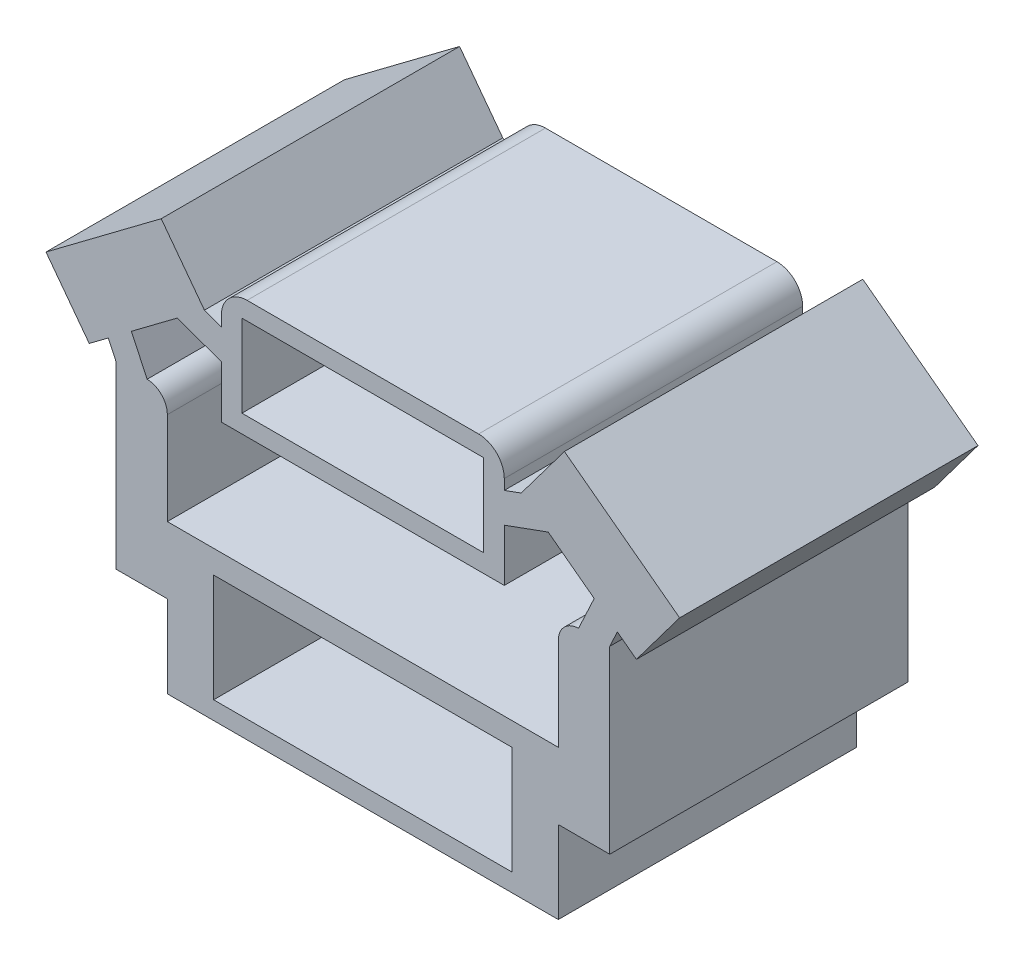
SolidWorks part; units mm, degrees
other "标注1"
sketch "草图17" plane through (-52.3494, -32.5127, 27.55) normal (0, 0, 1) x (1, 0, 0)
ref_plane "前视基准面" through (0, 0, 0) normal (0, 0, 1) x (1, 0, 0)
ref_plane "上视基准面" through (0, 0, 0) normal (0, 1, 0) x (1, 0, 0)
ref_plane "右视基准面" through (0, 0, 0) normal (1, 0, 0) x (0, 0, -1)
other "Configuration Table"
sketch "草图1" plane through (0, 0, 0) normal (0, 0, 1) x (1, 0, 0)
  line L0 (2.75, 5.2) -> (3.0789, 5.3197)
  line L1 (-3.8, -1.4) -> (3.8, -1.4)
  line L2 (-3.8, -1.4) -> (-3.8, 1.4)
  line L4 (3.8, -1.4) -> (3.8, 0.1)
  line L5 (-3.8, -1.4) -> (3.8, 1.4) construction
  line L6 (-3.8, 1.4) -> (3.8, -1.4) construction
  line L7 (-2.75, 5.2) -> (2.75, 5.2)
  line L8 (-2.75, 5.2) -> (-2.75, 3.6)
  line L9 (-2.75, 3.6) -> (2.75, 3.6)
  line L10 (2.75, 4.6147) -> (2.75, 3.6)
  line L11 (-2.75, 5.2) -> (2.75, 3.6) construction
  line L12 (-2.75, 3.6) -> (2.75, 5.2) construction
  line L14 (3.8, 0.1) -> (4.8, 0.1)
  line L17 (3.9192, 6.4395) -> (3.0789, 5.3197)
  line L19 (3.9192, 6.4395) -> (6.1588, 4.7589)
  line L33 (2.75, 5.2) -> (2.75, 4.6147) construction
  line L34 (3.0789, 5.3197) -> (3.6041, 4.9256) construction
  line L37 (4.8, 3.6) -> (4.8, 0.1)
  line L38 (-3.8, 1.4) -> (3.8, 1.4)
  line L39 (3.8, 1.4) -> (3.8, 0.1) construction
  line L40 (0, 9.062) -> (0, -4.0269) construction
  line L41 (2.75, 4.6147) -> (3.6041, 4.9256)
  line L48 (3.6041, 4.9256) -> (4.4984, 4.2545)
  line L51 (4.1931, 3.6) -> (4.4984, 4.2545)
  line L53 (4.9479, 3.9172) -> (5.3185, 3.6391)
  line L55 (4.4984, 4.2545) -> (4.9479, 3.9172) construction
  line L56 (4.1931, 3.6) -> (4.8, 3.6) construction
  line L57 (3.8, 1.4) -> (3.8, 3.6)
  line L58 (3.8, 3.6) -> (4.1931, 3.6)
  line L59 (4.8, 3.6) -> (4.9479, 3.9172)
  line L60 (5.3185, 3.6391) -> (6.1588, 4.7589)
  point P0 (0, 0)
  point P6 (0, 4.4)
  dimension "D1" = 7.6
  dimension "D2" = 2.8
  dimension "D3" = 5.5
  dimension "D4" = 1.6
  dimension "D5" = 1
  dimension "D6" = 65
  dimension "D7" = 0.35
  dimension "D8" = 0.55
  dimension "D9" = 3.5
  dimension "D10" = 1.4
  dimension "D11" = 0.55
  dimension "D12" = 2.2
  dimension "D13" = 0.35
  dimension "D14" = 2.2
  dimension "D15" = 2.8
  dimension "D16" = 110
extrude "凸台-拉伸1" add sketch "草图1" along normal blind 5.8
mirror "镜向1" about plane through (0, 0, 0) normal (1, 0, 0) of "凸台-拉伸1"
sketch "草图10" plane through (0, 0, 5.8) normal (0, 0, 1) x (1, 0, 0)
  line L0 (-2.75, 3.6) -> (2.75, 3.6) construction
  line L1 (-2.9, -1.05) -> (2.9, -1.05)
  line L2 (-2.9, -1.05) -> (-2.9, 1.05)
  line L3 (-2.9, 1.05) -> (2.9, 1.05)
  line L4 (2.9, -1.05) -> (2.9, 1.05)
  line L5 (-2.9, -1.05) -> (2.9, 1.05) construction
  line L6 (-2.9, 1.05) -> (2.9, -1.05) construction
  line L7 (-2.35, 5.55) -> (2.35, 5.55)
  line L8 (-2.35, 5.55) -> (-2.35, 3.95)
  line L9 (-2.35, 3.95) -> (2.35, 3.95)
  line L10 (2.35, 5.55) -> (2.35, 3.95)
  point P0 (0, 0)
  point P10 (0, 5.55)
  dimension "D1" = 5.8
  dimension "D2" = 2.1
  dimension "D3" = 4.7
  dimension "D4" = 1.6
  dimension "D5" = 0.35
extrude "切除-拉伸3" cut sketch "草图10" against normal through all
sketch "草图11" plane through (0, 0, 5.8) normal (0, 0, 1) x (1, 0, 0)
  line L0 (-2.35, 5.2) -> (-2.75, 5.2)
  line L1 (-2.75, 5.2) -> (-2.75, 5.9)
  line L2 (-2.75, 5.9) -> (2.75, 5.9)
  line L3 (2.75, 5.9) -> (2.75, 5.2)
  line L4 (2.75, 3.6) -> (2.75, 4.6147) construction
  line L5 (2.75, 5.2) -> (2.35, 5.2)
  line L6 (2.35, 5.2) -> (2.35, 5.55)
  line L7 (2.35, 5.55) -> (-2.35, 5.55)
  line L8 (-2.35, 5.55) -> (-2.35, 5.2)
  line L9 (-2.35, 3.95) -> (2.35, 3.95) construction
  dimension "D1" = 0.35
  dimension "D2" = 1.6
extrude "凸台-拉伸2" add sketch "草图11" against normal up to surface (5.8 mm away)
fillet "圆角1" radius 0.5 2 edges at (-2.75, 5.9, 2.9) (2.75, 5.9, 2.9)
sketch "草图12" plane through (0, 0, 5.8) normal (0, 0, 1) x (1, 0, 0)
  line L0 (-2.9, 1.05) -> (-2.9, -1.05) construction
  line L1 (-2.9, 0.95) -> (2.9, 0.95)
  line L2 (-2.9, 0.95) -> (-2.9, 1.05)
  line L3 (-2.9, 1.05) -> (2.9, 1.05)
  line L4 (2.9, 0.95) -> (2.9, 1.05)
  line L5 (3.8, -1.4) -> (3.8, 0.1) construction
  line L6 (-3.8, -1.4) -> (3.8, -1.4)
  line L7 (-3.8, -1.4) -> (-3.8, -1.5)
  line L8 (-3.8, -1.5) -> (3.8, -1.5)
  line L9 (3.8, -1.4) -> (3.8, -1.5)
  dimension "D1" = 0.1
  dimension "D2" = 0.1
extrude "凸台-拉伸3" add sketch "草图12" against normal up to surface (5.8 mm away)
sketch "草图14" plane through (0, 0, 5.8) normal (0, 0, 1) x (1, 0, 0)
  line L0 (2.9, -1.05) -> (2.9, 0.95) construction
  line L1 (-2.9, -1.05) -> (2.9, -1.05)
  line L2 (-2.9, -1.05) -> (-2.9, -1.15)
  line L3 (-2.9, -1.15) -> (2.9, -1.15)
  line L4 (2.9, -1.05) -> (2.9, -1.15)
  dimension "D1" = 0.1
extrude "切除-拉伸4" cut sketch "草图14" against normal through all
sketch "草图15" plane through (0, 0, 5.8) normal (0, 0, 1) x (1, 0, 0)
  line L0 (0, 5.2) -> (0, 1.4)
  line L2 (3.8, 1.4) -> (-3.8, 1.4) construction
  line L3 (0, 1.4) -> (3.8, 1.4)
  line L4 (3.8, 1.4) -> (3.8, 3.6)
  line L5 (3.8, 3.6) -> (4.8, 3.6)
  line L6 (4.8, 3.6) -> (4.9479, 3.9172)
  line L7 (4.9479, 3.9172) -> (3.0789, 5.3197)
  line L8 (3.0789, 5.3197) -> (2.75, 5.2)
  line L9 (2.75, 5.2) -> (0, 5.2)
sketch "草图16" plane through (0, 0, 5.8) normal (0, 0, 1) x (1, 0, 0)
  line L0 (-2.35, 5.55) -> (-2.35, 3.95) construction
  line L1 (-2.35, 4.05) -> (2.35, 4.05)
  line L2 (-2.35, 4.05) -> (-2.35, 3.95)
  line L3 (-2.35, 3.95) -> (2.35, 3.95)
  line L4 (2.35, 4.05) -> (2.35, 3.95)
  dimension "D1" = 0.1
extrude "凸台-拉伸4" [suppressed] add sketch "草图16" against normal up to surface (5.8 mm away)
fillet "圆角2" radius 0.4 2 edges at (-3.8, 3.6, 2.9) (3.8, 3.6, 2.9)
scale "缩放比例1" scale about centroid uniform scaling yes scale factor 8.5
